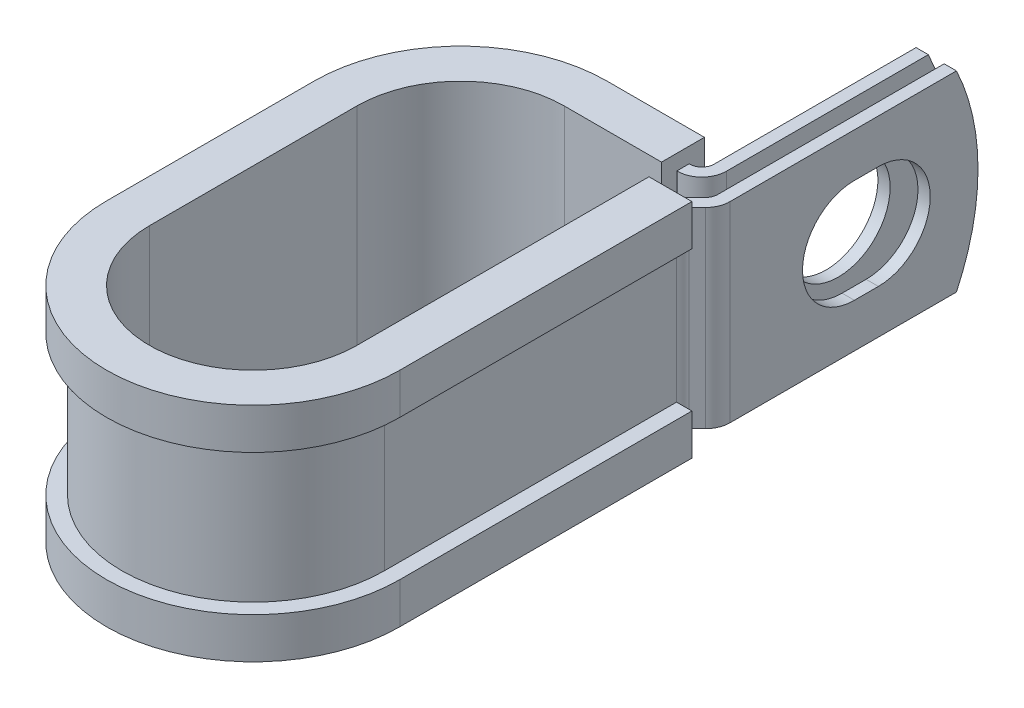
SolidWorks part; units mm, degrees
ref_plane "Front Plane" through (0, 0, 0) normal (0, 0, 1) x (1, 0, 0)
ref_plane "Top Plane" through (0, 0, 0) normal (0, 1, 0) x (1, 0, 0)
ref_plane "Right Plane" through (0, 0, 0) normal (1, 0, 0) x (0, 0, -1)
sketch "Sketch1" plane through (0, 0, 0) normal (0, 1, 0) x (1, 0, 0)
  line L0 (0, 11.8364) -> (9.7207, 11.8364)
  line L1 (11.8364, 0) -> (11.8364, 8.4239)
  line L2 (12.1591, 36.4998) -> (12.1591, 14.2748)
  line L3 (12.5506, 10.1481) -> (13.3768, 10.9743)
  line L4 (-11.8364, 0) -> (-11.8364, -20.6248)
  line L5 (13.7339, 11.8364) -> (13.7339, 36.4998)
  line L6 (11.8364, 0) -> (11.8364, -20.6248)
  arc A0 (0, 11.8364) -> (-11.8364, 0) centre (0, 0) ccw
  arc A1 (12.5506, 10.1481) -> (11.8364, 8.4239) centre (14.2748, 8.4239) ccw
  arc A2 (13.3768, 10.9743) -> (13.7339, 11.8364) centre (12.5147, 11.8364) ccw
  arc A3 (9.7207, 11.8364) -> (12.1591, 14.2748) centre (9.7207, 14.2748) ccw
  arc A4 (-11.8364, -20.6248) -> (11.8364, -20.6248) centre (0, -20.6248) ccw
extrude "Extrude-Thin1" add sketch "Sketch1" along normal mid plane 19.05 thin
sketch "Sketch2" plane through (10.9399, 0, 0) normal (-1, 0, 0) x (0, 0, 1)
  line L0 (-36.4998, 9.525) -> (-36.4998, -9.525) construction
  line L1 (0, 9.525) -> (0, -9.525) construction
  circle A0 centre (-25.4, 0) radius 5.1562
  point P2 (-36.4998, 0)
extrude "Cut-Extrude1" cut sketch "Sketch2" against normal up to surface (1.2192 mm away)
sketch "Sketch3" plane through (14.9531, 0, 0) normal (1, 0, 0) x (0, 0, -1)
  line L0 (24.2062, 0) -> (26.5938, 0) construction
  line L1 (24.2062, 5.1562) -> (26.5938, 5.1562)
  line L2 (24.2062, -5.1562) -> (26.5938, -5.1562)
  line L3 (36.4998, 9.525) -> (36.4998, -9.525) construction
  arc A0 (24.2062, 5.1562) -> (24.2062, -5.1562) centre (24.2062, 0) ccw
  arc A1 (26.5938, -5.1562) -> (26.5938, 5.1562) centre (26.5938, 0) ccw
  point P3 (25.4, 0)
  point P8 (36.4998, 0)
  point P11 (19.05, 0)
  point P12 (31.75, 0)
extrude "Cut-Extrude2" cut sketch "Sketch3" against normal up to surface (1.2192 mm away)
sketch "Sketch4" plane through (10.9399, 0, 0) normal (-1, 0, 0) x (0, 0, 1)
  line L0 (-36.4998, 9.525) -> (-36.4998, -9.525)
  line L1 (-36.4998, 9.525) -> (-34.3553, 9.525)
  line L2 (-36.4998, 9.525) -> (-14.2748, 9.525) construction
  line L3 (-36.4998, -9.525) -> (-34.3553, -9.525)
  line L4 (-36.4998, -9.525) -> (-14.2748, -9.525) construction
  arc A0 (-34.3553, 9.525) -> (-34.3553, -9.525) centre (-14.2748, 0) ccw
extrude "Cut-Extrude3" cut sketch "Sketch4" against normal through all contours A0 M4 M5 | A0 L0 M2
ref_plane "Plane1" through (0, 0, -8.4239) normal (0, 0, -1) x (-1, 0, 0)
ref_plane "Plane2" through (9.6699, 0, 0) normal (-1, 0, 0) x (0, 0, 1)
sketch "Sketch5" plane through (0, 0, -8.4239) normal (0, 0, -1) x (-1, 0, 0)
  line L0 (-13.0556, 9.525) -> (-11.8364, 9.525)
  line L1 (-13.0556, 9.525) -> (-13.0556, -9.525) construction
  line L3 (-11.8364, 9.525) -> (-11.8364, -9.525)
  line L4 (-11.8364, -9.525) -> (-13.0556, -9.525)
  line L5 (-13.0556, -9.525) -> (-13.0556, -6.985)
  line L6 (-13.0556, 9.525) -> (-13.0556, 6.985)
  line L7 (-14.5796, 11.049) -> (-14.5796, 6.985)
  line L8 (-14.5796, 11.049) -> (-10.3124, 11.049)
  line L9 (-10.3124, 11.049) -> (-10.3124, -11.049)
  line L10 (-10.3124, -11.049) -> (-14.5796, -11.049)
  line L11 (-14.5796, -11.049) -> (-14.5796, -6.985)
  line L12 (-14.5796, 6.985) -> (-13.0556, 6.985)
  line L13 (-13.0556, -6.985) -> (-14.5796, -6.985)
sketch "Sketch6" plane through (0, 9.525, 0) normal (0, 1, 0) x (1, 0, 0)
  line L0 (10.3124, 0) -> (10.3124, 8.4239)
  line L1 (10.3124, 8.4239) -> (14.5796, 8.4239) construction
  line L2 (9.6699, 6.9878) -> (9.6699, -6.9878) construction
  line L3 (10.3124, -20.6248) -> (10.3124, 0)
  line L4 (-10.3124, -20.6248) -> (-10.3124, 0)
  line L5 (0, 10.3124) -> (9.6699, 10.3124)
  arc A0 (0, 10.3124) -> (-10.3124, 0) centre (0, 0) ccw
  arc A1 (-10.3124, -20.6248) -> (10.3124, -20.6248) centre (0, -20.6248) ccw
sweep "Sweep1" add profiles "Sketch5" path "Sketch6"
equation "\"D4@Sketch5\" = \"D1@Extrude-Thin1\""
equation "\"D5@Sketch5\" = \"D5@Extrude-Thin1\""
equation "\"D1@Sketch3\" = \"D2@Sketch2\""
equation "\"D7@Sketch1\" = \"D3@Sketch2\" + \"D1@Sketch3\""
equation "\"D1@Sketch1\" = \"D1@Sketch6\" + 2 * \"D3@Sketch5\""
equation "\"D1@Sketch4\" = ( \"D1@Extrude-Thin1\" + .125 ) * 2"
equation "\"D9@Sketch1\"= \"D5@Extrude-Thin1\""
equation "\"D8@Sketch1\"= 2 * \"D5@Extrude-Thin1\""
equation "\"D2@Sketch1\" = 2 * \"D5@Extrude-Thin1\""
equation "\"D2@Sketch3\" = \"D1@Sketch2\""
equation "\"D6@Sketch1\" = \"D1@Sketch1\""
equation "\"D3@Sketch1\" = \"D1@Sketch6\""
